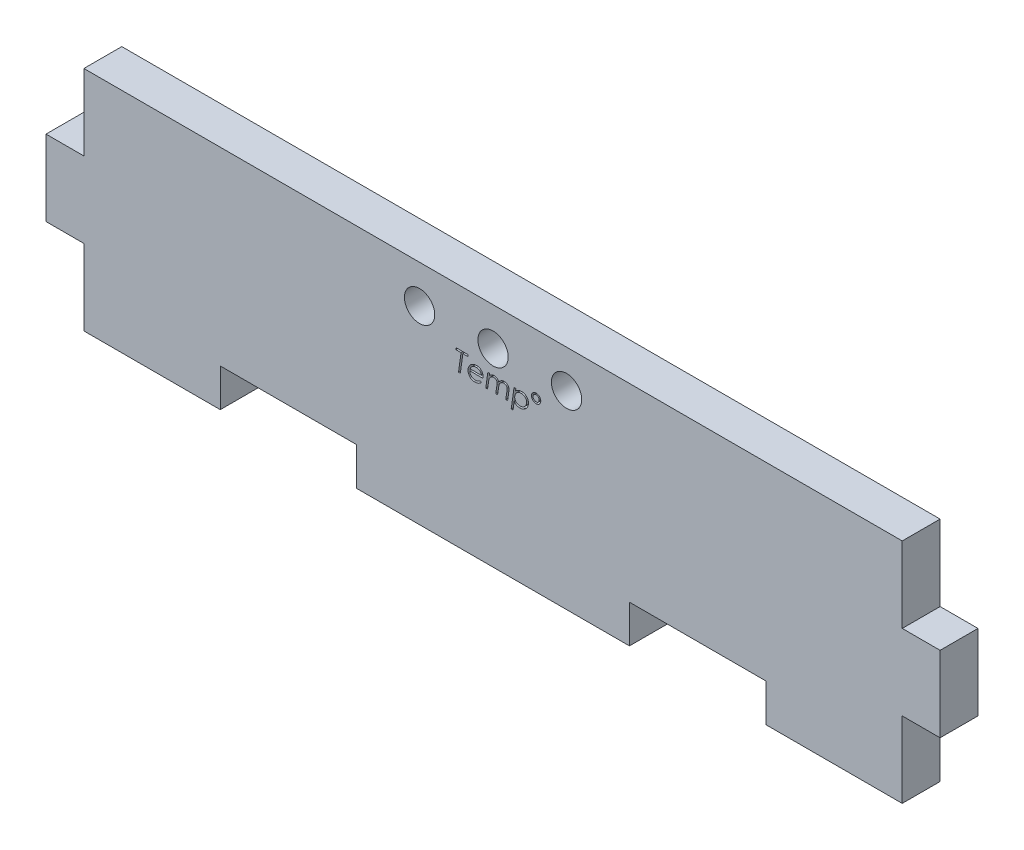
SolidWorks part; units mm, degrees
ref_plane "Plan de face" through (0, 0, 0) normal (0, 0, 1) x (1, 0, 0)
ref_plane "Plan de dessus" through (0, 0, 0) normal (0, 1, 0) x (1, 0, 0)
ref_plane "Plan de droite" through (0, 0, 0) normal (1, 0, 0) x (0, 0, -1)
sketch "Esquisse1" plane through (0, 0, 0) normal (0, 0, 1) x (1, 0, 0)
  line L1 (-59, 15) -> (59, 15)
  line L2 (-59, 15) -> (-59, -15)
  line L3 (-59, -15) -> (59, -15)
  line L4 (59, 15) -> (59, -15)
  line L5 (-59, 15) -> (59, -15) construction
  line L6 (-59, -15) -> (59, 15) construction
  point P0 (0, 0)
  dimension "D1" = 30
  dimension "D2" = 118
extrude "Boss.-Extru.1" add sketch "Esquisse1" along normal blind 5
sketch "Esquisse2" plane through (0, 0, 5) normal (0, 0, 1) x (1, 0, 0)
  line L0 (-11.7, 10) -> (11.7, 10) construction
  line L1 (59, 15) -> (-59, 15) construction
  circle A0 centre (-9.7, 10) radius 2
  circle A1 centre (9.7, 10) radius 2
  point P6 (0, 10)
  dimension "D1" = 4
  dimension "D2" = 11.7
  dimension "D3" = 5
extrude "Enlèv. mat.-Extru.1" cut sketch "Esquisse2" against normal through all both and the other way through all
sketch "Esquisse3" plane through (0, 0, 5) normal (0, 0, 1) x (1, 0, 0)
  line L0 (-59, 15) -> (-59, 5) construction
  line L1 (-59, 15) -> (-54, 15)
  line L2 (-59, 15) -> (-59, 5)
  line L3 (-59, 5) -> (-54, 5)
  line L4 (-54, 15) -> (-54, 5)
  line L5 (-59, 5) -> (-59, -5) construction
  line L6 (-59, -5) -> (-59, -15) construction
  line L7 (-59, -15) -> (59, -15) construction
  line L8 (-59, 15) -> (-59, -15) construction
  line L9 (-54, -15) -> (-36, -15) construction
  line L10 (-59, -15) -> (-54, -15)
  line L11 (-59, -15) -> (-59, -5)
  line L12 (-59, -5) -> (-54, -5)
  line L13 (-54, -15) -> (-54, -5)
  line L18 (-36, -15) -> (-18, -15) construction
  line L19 (-18, -15) -> (0, -15) construction
  line L21 (-36, -15) -> (-18, -15)
  line L22 (-36, -15) -> (-36, -10)
  line L23 (-36, -10) -> (-18, -10)
  line L24 (-18, -15) -> (-18, -10)
  dimension "D1" = 5
extrude "Enlèv. mat.-Extru.2" cut sketch "Esquisse3" against normal through all both and the other way through all
ref_plane "Plan1" through (0, 0, 0) normal (-1, 0, 0) x (0, 0, 1)
mirror "Symétrie1" about plane through (0, 0, 0) normal (-1, 0, 0) of "Enlèv. mat.-Extru.2"
sketch "Esquisse4" plane through (0, 0, 5) normal (0, 0, 1) x (1, 0, 0)
  line L0 (-9.7, 10) -> (0, 10) construction
  line L1 (0, 10) -> (9.7, 10) construction
  circle A0 centre (0, 10) radius 2
  circle A1 centre (9.7, 10) radius 2 construction
  circle A3 centre (-9.7, 10) radius 2 construction
  dimension "D1" = 4
extrude "Enlèv. mat.-Extru.3" cut sketch "Esquisse4" against normal through all both and the other way through all
sketch "Esquisse5" plane through (0, 0, 5) normal (0, 0, 1) x (1, 0, 0)
  line L0 (-5, 5) -> (5, 5) construction
  line L1 (-5, 5) -> (-9.7, 10) construction
  line L3 (5, 5) -> (9.7, 10) construction
  circle A0 centre (-9.7, 10) radius 2 construction
  circle A1 centre (9.7, 10) radius 2 construction
  circle A3 centre (0, 10) radius 2 construction
  text T0 "<i>Temp°</i>" font "Century Gothic" height in points 10
  dimension "D1" = 5
  dimension "D2" = 10
extrude "Enlèv. mat.-Extru.4" cut sketch "Esquisse5" against normal blind 1
